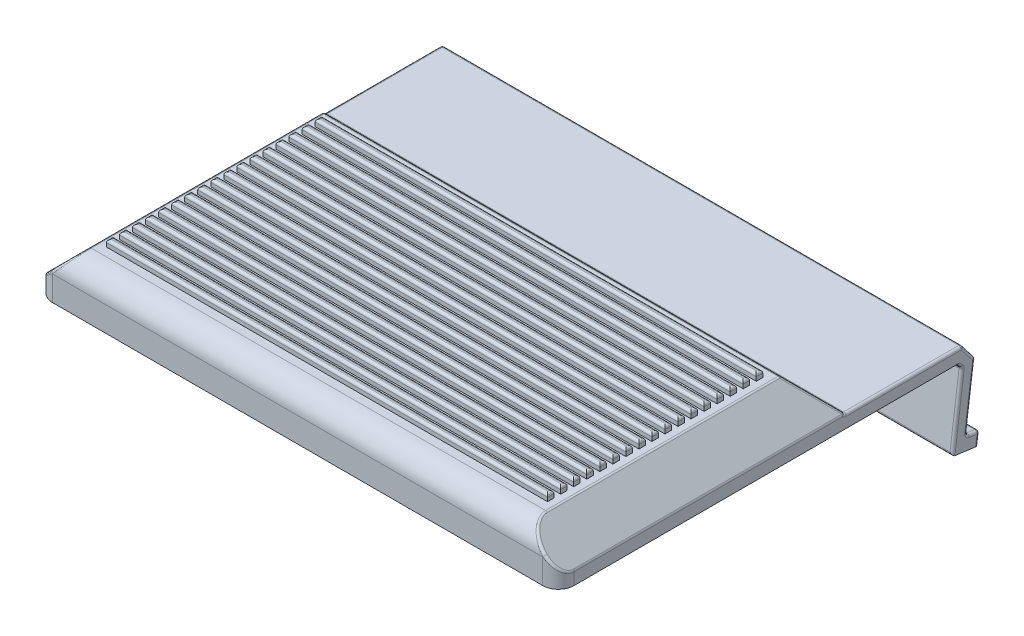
SolidWorks part; units mm, degrees
ref_plane "Front" through (0, 0, 0) normal (0, 0, 1) x (1, 0, 0)
ref_plane "Top" through (0, 0, 0) normal (0, 1, 0) x (1, 0, 0)
ref_plane "Right" through (0, 0, 0) normal (1, 0, 0) x (0, 0, -1)
sketch "Sketch2" plane through (0, 0, 0) normal (0, 1, 0) x (1, 0, 0)
  line L1 (0, 0) -> (63.5, 0)
  line L2 (0, 0) -> (0, 49.2125)
  line L3 (0, 49.2125) -> (63.5, 49.2125)
  line L4 (63.5, 0) -> (63.5, 49.2125)
  dimension "D1" = 49.2125
  dimension "D2" = 63.5
extrude "Extrude1" add sketch "Sketch2" along normal blind 1.5875
sketch "Sketch3" plane through (0, 1.5875, 0) normal (0, 1, 0) x (-1, 0, 0)
  line L0 (0, -49.2125) -> (0, 0) construction
  line L1 (-63.5, 0) -> (0, 0)
  line L2 (-63.5, 0) -> (-63.5, -34.925)
  line L3 (-63.5, -34.925) -> (0, -34.925)
  line L4 (0, 0) -> (0, -34.925)
  dimension "D1" = 34.925
extrude "Extrude2" add sketch "Sketch3" along normal blind 3.9688
chamfer "Chamfer2" distance 3.9688 angle 45 3 edges at (63.5, 5.5563, -17.4625) (31.75, 5.5563, -34.925) (0, 5.5563, -17.4625)
shell "Shell1" thickness 1.5875
fillet "Fillet1" radius 1.905 2 edges at (0, 0.7937, 0) (63.5, 0.7937, 0)
fillet "Fillet4" radius 2.54 1 edges at (31.75, 5.5562, 0)
fillet "Fillet12" radius 0.3175 14 edges at (63.018, 2.0695, -0.6385) (60.1871, 4.9004, -0.8366) (59.5312, 5.5563, -16.7481) (31.75, 5.5563, -30.9562) (3.9688, 5.5563, -16.7481) (3.3129, 4.9004, -0.8366) (0.482, 2.0695, -0.6385)
sketch "Sketch8" plane through (0, 0, 0) normal (1, 0, 0) x (0, 0, -1)
  line L0 (49.2125, 0) -> (75.7074, -3.5069) construction
  line L1 (49.2125, 0) -> (1.905, 0) construction
  line L2 (49.2125, 0) -> (1.905, 0) construction
  line L3 (49.2125, 0) -> (46.4385, -20.9579) construction
  line L4 (49.2125, 0) -> (52.3875, 0) construction
  line L5 (52.3875, 0) -> (52.3875, 17.1152) construction
  line L6 (47.9626, -9.4426) -> (62.7303, -11.3973) construction
  line L7 (47.9626, -9.4426) -> (49.2125, 0)
  line L9 (47.9626, -9.4426) -> (51.1102, -9.8593)
  line L10 (49.7447, -8.0772) -> (50.7596, -0.41)
  line L11 (49.2125, 1.5875) -> (50.7596, -0.41)
  line L12 (49.2125, 1.5875) -> (49.2125, 0)
  line L14 (51.1102, -9.8593) -> (51.3185, -8.2855)
  line L15 (49.7447, -8.0772) -> (51.3185, -8.2855)
  dimension "D1" = 172.46
  dimension "D2" = 3.175
  dimension "D3" = 9.525
  dimension "D4" = 1.5875
  dimension "D6" = 1.5875
  dimension "D7" = 3.175
extrude "Extrude8" add sketch "Sketch8" along normal up to vertex
sketch "Sketch4" plane through (0, 5.5563, 0) normal (0, 1, 0) x (-1, 0, 0)
  line L0 (-4.1003, -16.6824) -> (-59.3997, -16.6824) construction
  line L2 (-4.894, -17.0792) -> (-58.606, -17.0792)
  line L3 (-4.894, -17.0792) -> (-4.894, -16.2855)
  line L12 (-4.894, -16.2855) -> (-58.606, -16.2855)
  line L13 (-58.606, -17.0792) -> (-58.606, -16.2855)
  point P11 (-58.606, -16.6824)
  dimension "D4" = 0.7937
extrude "Extrude6" add sketch "Sketch4" along normal blind 0.7937
fillet "Fillet13" radius 0.3175 4 edges at (31.75, 6.35, -17.0792) (58.606, 6.35, -16.6824) (31.75, 6.35, -16.2855) (4.894, 6.35, -16.6824)
pattern_linear "LPattern3" count 9 spacing 1.5875 along (0, 0, -1) of "Extrude6", "Fillet13"
pattern_linear "LPattern4" count 9 spacing 1.5875 along (0, 0, 1) of "Extrude6", "Fillet13"
ref_plane "Plane1" through (0, 0, -14.2875) normal (0, 0, -1) x (-1, 0, 0)
sketch "Sketch6" plane through (0, 0, 0) normal (0, -1, 0) x (1, 0, 0)
  line L0 (61.9125, -1.5875) -> (61.9125, -34.2674) construction
  line L1 (1.5875, -34.2674) -> (1.5875, -1.5875) construction
  line L2 (61.9125, -34.2674) -> (1.5875, -34.2674) construction
  line L3 (1.5875, -1.5875) -> (61.9125, -1.5875) construction
  line L4 (61.9125, -1.5875) -> (61.9125, -34.2674) construction
  line L5 (1.5875, -34.2674) -> (1.5875, -1.5875) construction
  line L6 (61.9125, -34.2674) -> (1.5875, -34.2674) construction
  line L7 (1.5875, -1.5875) -> (61.9125, -1.5875) construction
  line L8 (15.875, -1.5875) -> (15.875, -34.2674)
  line L9 (47.625, -1.5875) -> (47.625, -34.2674)
  line L10 (1.5875, -11.1125) -> (61.9125, -11.1125)
  line L11 (1.5875, -23.8125) -> (61.9125, -23.8125)
  dimension "D1" = 14.2875
  dimension "D2" = 14.2875
  dimension "D3" = 9.525
  dimension "D4" = 12.7
rib "Rib8" sketch "Sketch6" sketch "Sketch6" thickness 0.7937 extrusion direction normal to sketch draft on no parameters "D1"=0.7937
fillet "Fillet16" radius 0.3175 2 edges at (63.5, 0.5888, -49.986) (0, 0.5888, -49.986)
chamfer "Chamfer3" distance 0.7937 angle 45 1 edges at (31.75, 0, -49.2125)
fillet "Fillet17" radius 0.3175 20 edges at (0, -0.3505, -48.7692) (63.5, -0.3505, -48.7692) (31.75, -9.4426, -47.9626) (63.5, -5.0718, -48.5412) (0, -5.0718, -48.5412) (31.75, -0.701, -49.1197) (31.75, -8.2855, -51.3185) (0, -8.1813, -50.5316) (63.5, -8.1813, -50.5316) (0.093, -0.5397, -50.7424) (0, -4.465, -50.2228) (31.75, -8.0772, -49.7447) (63.5, -4.465, -50.2228) (63.407, -0.5397, -50.7424) (31.75, -0.41, -50.7596) (63.407, 1.4945, -49.1669) (0.093, 1.4945, -49.1669) (31.75, 1.5875, -49.2125) (0, -9.0724, -51.2143) (63.5, -9.0724, -51.2143)
sketch "Sketch7" plane through (0, 3.9688, 0) normal (0, -1, 0) x (1, 0, 0)
  line L0 (16.2719, -17.4625) -> (47.2281, -17.4625) construction
  line L1 (31.75, -11.5094) -> (31.75, -23.4156) construction
  line L2 (30.9563, -18.2563) -> (30.9563, -20.6375)
  line L3 (30.9563, -14.2875) -> (32.5438, -14.2875)
  line L4 (16.2719, -11.5094) -> (16.2719, -23.4156)
  line L5 (16.2719, -23.4156) -> (47.2281, -23.4156)
  line L6 (47.2281, -23.4156) -> (47.2281, -11.5094)
  line L7 (47.2281, -11.5094) -> (16.2719, -11.5094)
  line L8 (16.2719, -11.5094) -> (16.2719, -23.4156) construction
  line L9 (16.2719, -23.4156) -> (47.2281, -23.4156) construction
  line L10 (47.2281, -23.4156) -> (47.2281, -11.5094) construction
  line L11 (47.2281, -11.5094) -> (16.2719, -11.5094) construction
  line L12 (30.9563, -14.2875) -> (30.9563, -16.6688)
  line L13 (30.9563, -20.6375) -> (32.5438, -20.6375)
  line L14 (32.5438, -14.2875) -> (32.5438, -16.6688)
  line L15 (28.575, -16.6688) -> (30.9563, -16.6688)
  line L16 (28.575, -16.6688) -> (28.575, -18.2563)
  line L17 (28.575, -18.2563) -> (30.9563, -18.2563)
  line L18 (34.925, -16.6688) -> (34.925, -18.2563)
  line L19 (32.5438, -16.6688) -> (34.925, -16.6688)
  line L20 (32.5438, -18.2563) -> (32.5438, -20.6375)
  line L21 (32.5438, -18.2563) -> (34.925, -18.2563)
  circle A0 centre (31.75, -17.4625) radius 5.08 construction
  point P16 (28.575, -17.4625)
  point P17 (31.75, -20.6375)
  dimension "D2" = 1.5875
  dimension "D3" = 1.5875
  dimension "D4" = 3.175
  dimension "D5" = 3.175
  dimension "D6" = 3.175
  dimension "D7" = 3.175
  dimension "D1" = 0
ref_plane "Plane2" through (31.75, 0, 0) normal (1, 0, 0) x (0, 0, -1)
sketch "Sketch9" plane through (31.75, 0, 0) normal (1, 0, 0) x (0, 0, -1)
  line L0 (49.2125, 0) -> (46.4385, -20.9579) construction
  line L1 (49.2125, 0) -> (46.4385, -20.9579) construction
  line L2 (11.5094, 3.9688) -> (23.4156, 3.9688) construction
  line L3 (11.5094, 3.9688) -> (23.4156, 3.9688) construction
  line L4 (17.4625, 3.9688) -> (16.6293, -2.3263)
  dimension "D1" = 6.35
sweep "Sweep1" add profiles "Sketch7" path "Sketch9"
fillet "Fillet18" radius 0.3175 72 edges at (32.5438, 3.9688, -15.4781) (32.5438, -2.3263, -14.6449) (33.7344, 3.9688, -16.6688) (33.7344, -2.3263, -15.8355) (32.5438, 0.8212, -16.2521) (34.925, 3.9688, -17.4625) (34.925, -2.3263, -16.6293) (34.925, 0.8212, -16.2521) (33.7344, 3.9688, -18.2563) (33.7344, -2.3263, -17.423) (34.925, 0.8212, -17.8396) (32.5438, 3.9688, -19.4469) (32.5438, -2.3263, -18.6136) (32.5438, 0.8212, -17.8396) (31.75, 3.9688, -20.6375) (31.75, -2.3263, -19.8043) (32.5438, 0.8212, -20.2209) (30.9563, 3.9688, -19.4469) (30.9563, -2.3263, -18.6136) (30.9563, 0.8212, -20.2209) (29.7656, 3.9688, -18.2563) (29.7656, -2.3263, -17.423) (30.9563, 0.8212, -17.8396) (28.575, 3.9688, -17.4625) (28.575, -2.3263, -16.6293) (28.575, 0.8212, -17.8396) (29.7656, 3.9688, -16.6688) (29.7656, -2.3263, -15.8355) (28.575, 0.8212, -16.2521) (32.5438, 0.8212, -13.8709) (31.75, 3.9688, -14.2875) (31.75, -2.3263, -13.4543) (30.9563, 0.8212, -13.8709) (30.9563, 3.9688, -15.4781) (30.9563, -2.3263, -14.6449) (30.9563, 0.8212, -16.2521) (53.4478, 3.9688, -1.5875) (58.8737, 3.9688, -6.1516) (53.4478, 3.9688, -10.7156) (48.0219, 3.9688, -6.1516) (53.4478, 3.9688, -11.5094) (58.8737, 3.9688, -17.4625) (53.4478, 3.9688, -23.4156) (48.0219, 3.9688, -17.4625) (58.8737, 3.9688, -27.254) (53.4478, 3.9688, -30.2987) (48.0219, 3.9688, -27.254) (53.4478, 3.9688, -24.2094) (47.2281, 3.9688, -27.254) (31.75, 3.9688, -30.2987) (16.2719, 3.9688, -27.254) (31.75, 3.9688, -24.2094) (15.4781, 3.9688, -27.254) (10.0522, 3.9688, -30.2987) (4.6263, 3.9688, -27.254) (10.0522, 3.9688, -24.2094) (31.75, 3.9688, -11.5094) (47.2281, 3.9688, -17.4625) (31.75, 3.9688, -23.4156) (16.2719, 3.9688, -17.4625) (31.75, 3.9688, -1.5875) (47.2281, 3.9688, -6.1516) (31.75, 3.9688, -10.7156) (16.2719, 3.9688, -6.1516) (10.0522, 3.9688, -1.5875) (15.4781, 3.9688, -6.1516) (10.0522, 3.9688, -10.7156) (4.6263, 3.9688, -6.1516) (10.0522, 3.9688, -11.5094) (15.4781, 3.9688, -17.4625) (10.0522, 3.9688, -23.4156) (4.6263, 3.9688, -17.4625)
